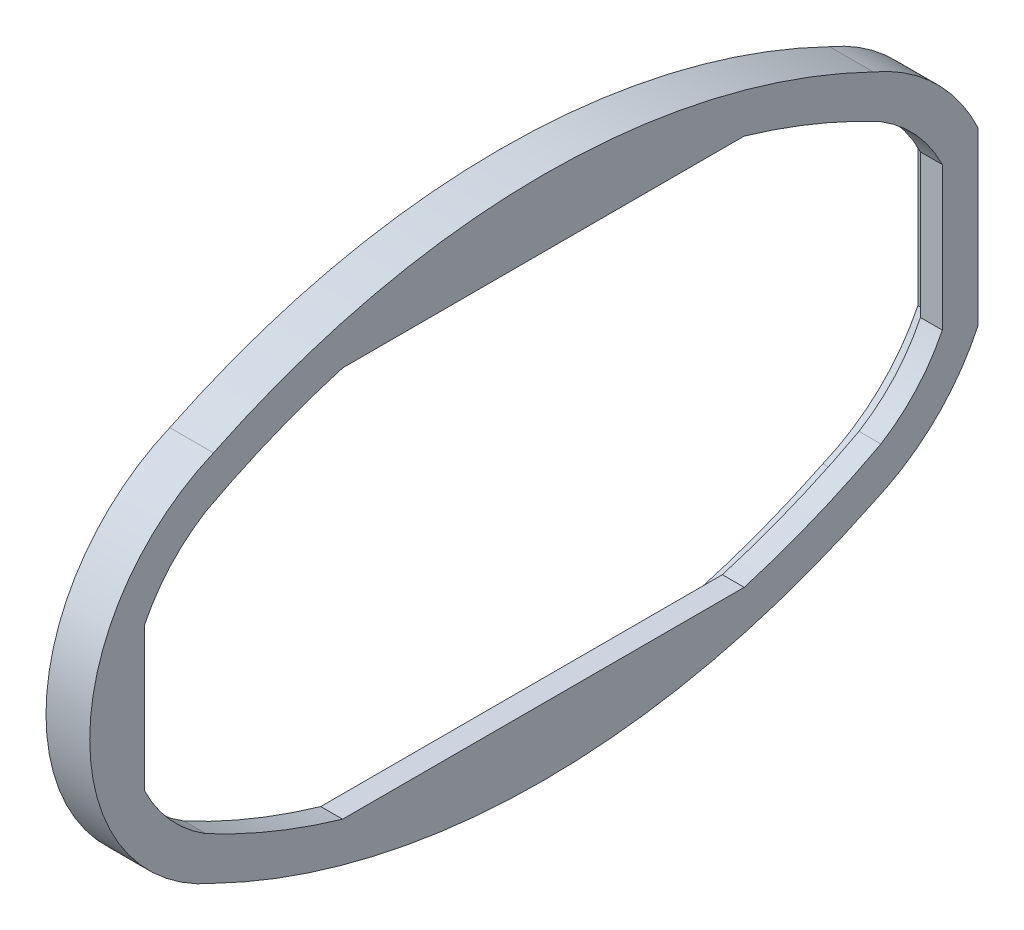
SolidWorks part; units mm, degrees
ref_plane "Front" through (0, 0, 0) normal (0, 0, 1) x (1, 0, 0)
ref_plane "Top" through (0, 0, 0) normal (0, 1, 0) x (1, 0, 0)
ref_plane "Right" through (0, 0, 0) normal (1, 0, 0) x (0, 0, -1)
sketch "Sketch1" plane through (0, 0, 0) normal (1, 0, 0) x (0, 0, -1)
  line L0 (0, 45) -> (0, 0) construction
  line L1 (0, 0) -> (0, -22.5) construction
  line L2 (-29.559, -15.6837) -> (29.559, -15.6837) construction
  line L3 (0, 0) -> (-32.5, 0) construction
  line L4 (38.2561, 7.5) -> (38.2561, -7.5)
  line L5 (39.7561, 7.841) -> (39.7561, -7.841)
  arc A0 (0, -22.5) -> (-29.559, -15.6837) centre (0, 45) cw
  arc A1 (0, -22.5) -> (29.559, -15.6837) centre (0, 45) ccw
  arc A2 (0, 22.5) -> (-29.559, 15.6837) centre (0, -45) ccw
  arc A3 (0, 22.5) -> (29.559, 15.6837) centre (0, -45) cw
  arc A4 (-29.559, -15.6837) -> (-29.559, 15.6837) centre (-23, 0) cw
  arc A5 (29.559, -15.6837) -> (38.2561, -7.5) centre (23, 0) ccw
  arc A6 (38.2561, 7.5) -> (29.559, 15.6837) centre (23, 0) ccw
  arc A7 (-30.1779, -17.0507) -> (-30.1779, 17.0507) centre (-23, 0) cw
  arc A8 (0, 24) -> (-30.1779, 17.0507) centre (0, -45) ccw
  arc A9 (0, 24) -> (30.1779, 17.0507) centre (0, -45) cw
  arc A10 (39.7561, 7.841) -> (30.1779, 17.0507) centre (23, 0) ccw
  arc A11 (30.1779, -17.0507) -> (39.7561, -7.841) centre (23, 0) ccw
  arc A12 (0, -24) -> (30.1779, -17.0507) centre (0, 45) ccw
  arc A13 (0, -24) -> (-30.1779, -17.0507) centre (0, 45) cw
  dimension "D5" = 23
  dimension "D4" = 17
  dimension "D1" = 45
  dimension "D2" = 22.5
  dimension "D3" = 32.5
  dimension "D6" = 15
  dimension "D7" = 1.5
extrude "Extrude1" add sketch "Sketch1" along normal blind 2
sketch "Sketch2" plane through (2, 0, 0) normal (1, 0, 0) x (0, 0, -1)
  line L0 (0, 0) -> (-44.7942, 0) construction
  line L1 (39.7561, 7.841) -> (39.7561, -7.841)
  line L2 (39.7561, -7.841) -> (39.7561, 7.841) construction
  arc A0 (-30.1779, 17.0507) -> (30.1779, 17.0507) centre (0, -45) cw
  arc A1 (-30.1779, 17.0507) -> (-30.1779, -17.0507) centre (-23, 0) ccw
  arc A3 (30.1779, 17.0507) -> (39.7561, 7.841) centre (23, 0) cw
  arc A4 (30.1779, -17.0507) -> (39.7561, -7.841) centre (23, 0) ccw
  arc A5 (-30.1779, -17.0507) -> (30.1779, -17.0507) centre (0, 45) ccw
  point P20 (39.7561, 0)
extrude "Extrude2" add sketch "Sketch2" along normal blind 2
sketch "Sketch4" plane through (4, 0, 0) normal (1, 0, 0) x (0, 0, -1)
  line L0 (35.9904, -7.5) -> (35.9904, 7.5)
  line L1 (-35.9904, 7.5) -> (-35.9904, -7.5)
  line L2 (-20, 17.3719) -> (20, 17.3719)
  line L3 (0, 0) -> (29.4553, 0) construction
  line L4 (-20, -17.3719) -> (20, -17.3719)
  arc A0 (35.9904, 7.5) -> (30.8737, 12.7673) centre (23, 0) ccw
  arc A1 (30.8737, 12.7673) -> (20, 17.3719) centre (0, -45) ccw
  arc A2 (-30.8737, 12.7673) -> (-35.9904, 7.5) centre (-23, 0) ccw
  arc A3 (35.9904, -7.5) -> (30.8737, -12.7673) centre (23, 0) cw
  arc A4 (-35.9904, -7.5) -> (-30.8737, -12.7673) centre (-23, 0) ccw
  arc A5 (-30.8737, -12.7673) -> (-20, -17.3719) centre (0, 45) ccw construction
  arc A6 (-30.8737, -12.7673) -> (-20, -17.3719) centre (0, 45) ccw
  arc A7 (-20, 17.3719) -> (-30.8737, 12.7673) centre (0, -45) ccw
  arc A8 (30.1779, 17.0507) -> (-30.1779, 17.0507) centre (0, -45) ccw construction
  arc A9 (-30.1779, 17.0507) -> (-30.1779, -17.0507) centre (-23, 0) ccw construction
  arc A10 (-30.1779, -17.0507) -> (30.1779, -17.0507) centre (0, 45) ccw construction
  arc A11 (30.1779, -17.0507) -> (39.7561, -7.841) centre (23, 0) ccw construction
  arc A12 (20, -17.3719) -> (30.8737, -12.7673) centre (0, 45) ccw
  dimension "D1" = 40
extrude "Cut-Extrude1" cut sketch "Sketch4" against normal through all
sketch "Sketch5" plane through (4, 0, 0) normal (1, 0, 0) x (0, 0, -1)
  line L0 (-36.4904, 6.5582) -> (-36.4904, -6.5582)
  line L1 (0, 0) -> (-44.0107, 0) construction
  line L2 (0, 0) -> (0, 29.0514) construction
  line L3 (-35.9904, 7.5) -> (-35.9904, -7.5) construction
  line L4 (18.3679, 17.8719) -> (-18.3679, 17.8719)
  line L5 (20, 17.3719) -> (-20, 17.3719) construction
  line L6 (36.4904, 6.5582) -> (36.4904, -6.5582)
  line L7 (18.3679, -17.8719) -> (-18.3679, -17.8719)
  arc A0 (-36.4904, 6.5582) -> (-30.8737, 12.7673) centre (-23, 0) cw
  arc A1 (-30.8737, 12.7673) -> (-18.3679, 17.8719) centre (0, -45) cw
  arc A2 (-20, 17.3719) -> (-30.8737, 12.7673) centre (0, -45) ccw construction
  arc A3 (-30.1779, 17.0507) -> (-30.1779, -17.0507) centre (-23, 0) ccw construction
  arc A5 (36.4904, 6.5582) -> (30.8737, 12.7673) centre (23, 0) ccw
  arc A6 (30.8737, 12.7673) -> (18.3679, 17.8719) centre (0, -45) ccw
  arc A7 (-36.4904, -6.5582) -> (-30.8737, -12.7673) centre (-23, 0) ccw
  arc A8 (-30.8737, -12.7673) -> (-18.3679, -17.8719) centre (0, 45) ccw
  arc A9 (36.4904, -6.5582) -> (30.8737, -12.7673) centre (23, 0) cw
  arc A10 (30.8737, -12.7673) -> (18.3679, -17.8719) centre (0, 45) cw
  arc A11 (-30.8737, 12.7673) -> (-35.9904, 7.5) centre (-23, 0) ccw construction
  point P29 (0, 17.8719)
  point P30 (-36.4904, 0)
  point P36 (36.4904, 0)
  dimension "D3" = 0.5
  dimension "D4" = 0.5
extrude "0.5mm_paint" cut sketch "Sketch5" against normal through all
